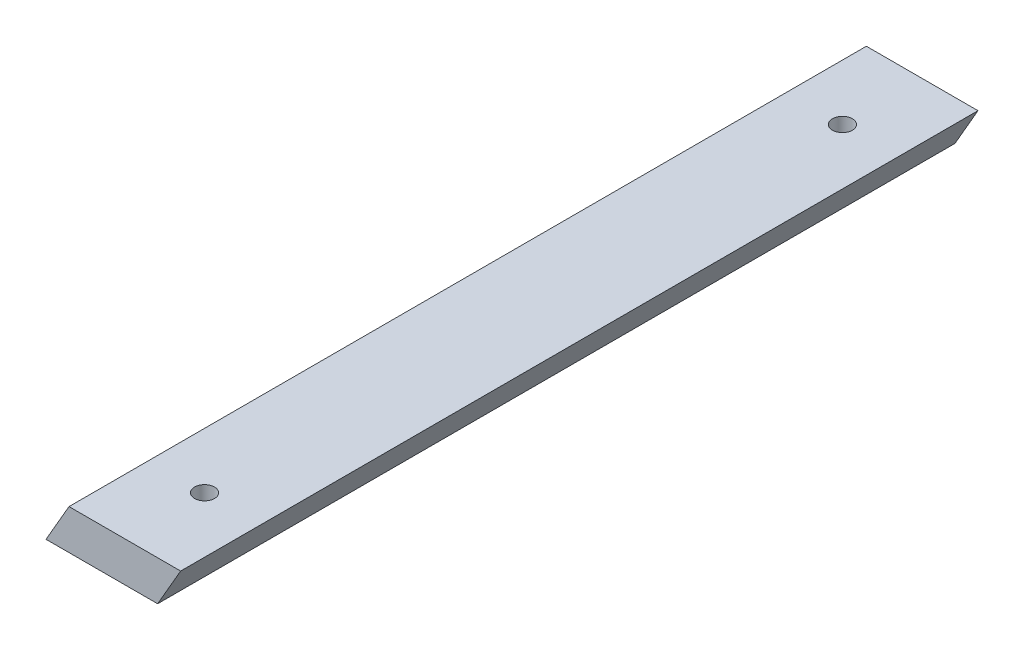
SolidWorks part; units mm, degrees
ref_plane "Front Plane" through (0, 0, 0) normal (0, 0, 1) x (1, 0, 0)
ref_plane "Top Plane" through (0, 0, 0) normal (0, 1, 0) x (1, 0, 0)
ref_plane "Right Plane" through (0, 0, 0) normal (1, 0, 0) x (0, 0, -1)
sketch "Sketch1" plane through (0, 0, 0) normal (0, 0, 1) x (1, 0, 0)
  line L0 (14, 5) -> (8.2265, -5)
  line L1 (14, -5) -> (-14, -5)
  line L2 (14, -5) -> (14, 5)
  line L3 (14, 5) -> (-14, 5)
  line L4 (-14, -5) -> (-14, 5)
  line L5 (14, -5) -> (-14, 5) construction
  line L6 (14, 5) -> (-14, -5) construction
  line L7 (-14, 5) -> (-19.7735, -5)
  line L8 (-19.7735, -5) -> (-14, -5)
  point P0 (0, 0)
  dimension "D1" = 10
  dimension "D2" = 28
  dimension "D3" = 120
extrude "Boss-Extrude1" add sketch "Sketch1" along normal mid plane 200 contours L7 L8 L4 | L4 L1 L0 L3
sketch "Sketch2" plane through (0, 5, 0) normal (0, 1, 0) x (1, 0, 0)
  line L1 (0, -80) -> (0, -100) construction
  line L2 (14, -100) -> (-14, -100) construction
  circle A0 centre (0, -80) radius 2.5
  dimension "D1" = 5
  dimension "D2" = 20
extrude "Cut-Extrude1" cut sketch "Sketch2" against normal through all
mirror "Mirror1" about plane through (0, 0, 0) normal (0, 0, 1) of "Cut-Extrude1"
